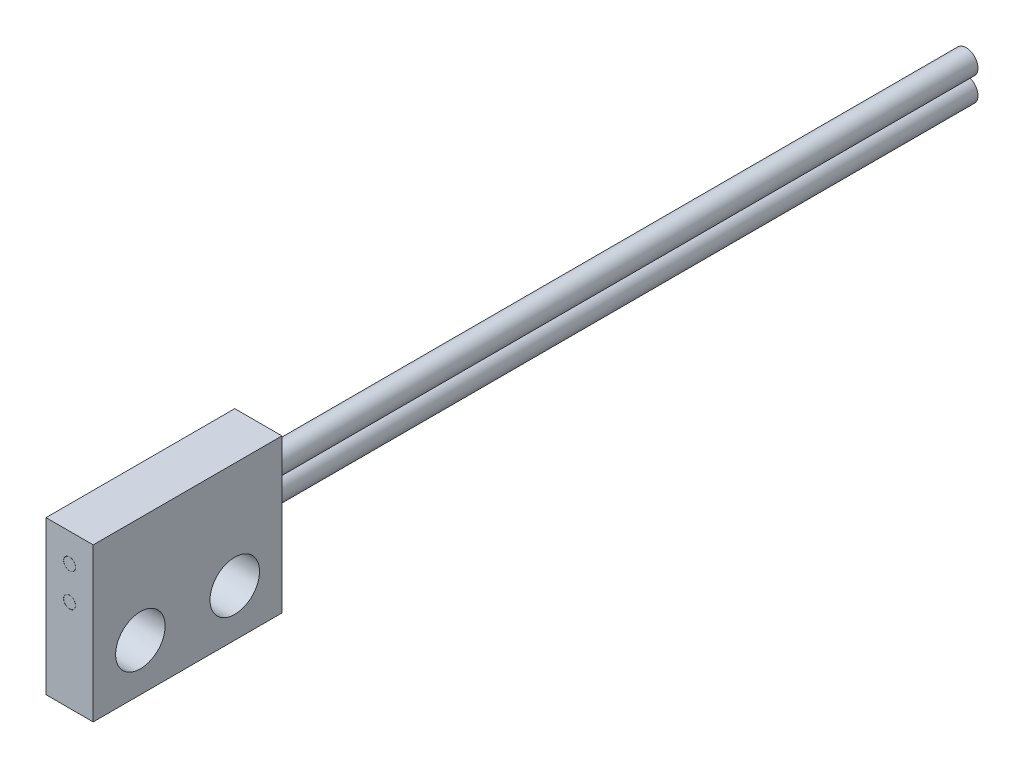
SolidWorks part; units mm, degrees
ref_plane "前视基准面" through (0, 0, 0) normal (0, 0, 1) x (1, 0, 0)
ref_plane "上视基准面" through (0, 0, 0) normal (0, 1, 0) x (1, 0, 0)
ref_plane "右视基准面" through (0, 0, 0) normal (1, 0, 0) x (0, 0, -1)
sketch "草图1" plane through (0, 0, 0) normal (1, 0, 0) x (0, 0, -1)
  line L1 (4, -3.25) -> (-4, -3.25)
  line L2 (4, -3.25) -> (4, 3.25)
  line L3 (4, 3.25) -> (-4, 3.25)
  line L4 (-4, -3.25) -> (-4, 3.25)
  line L5 (4, -3.25) -> (-4, 3.25) construction
  line L6 (4, 3.25) -> (-4, -3.25) construction
  point P0 (0, 0)
  dimension "D1" = 8
  dimension "D2" = 6.5
extrude "凸台-拉伸1" add sketch "草图1" along normal mid plane 2
sketch "草图2" plane through (1, 0, 0) normal (1, 0, 0) x (0, 0, -1)
  line L0 (-4, -3.25) -> (4, -3.25) construction
  line L1 (-4, 3.25) -> (-4, -3.25) construction
  circle A0 centre (-2, -1.25) radius 1.05
  circle A1 centre (2, -1.25) radius 1.05
  point P4 (0, 0)
  dimension "D1" = 2.1
  dimension "D2" = 4
  dimension "D3" = 2
  dimension "D4" = 2
extrude "切除-拉伸1" cut sketch "草图2" against normal blind 2
sketch "草图3" plane through (0, 0, 4) normal (0, 0, 1) x (1, 0, 0)
  line L0 (1, 3.25) -> (-1, 3.25) construction
  circle A0 centre (0, 2.05) radius 0.25
  circle A1 centre (0, 0.65) radius 0.25
  circle A2 centre (0, 2.05) radius 0.255
  circle A3 centre (0, 0.65) radius 0.255
  dimension "D1" = 0.5
  dimension "D4" = 0.51
  dimension "D5" = 0.51
  dimension "D2" = 1.4
  dimension "D3" = 1.2
extrude "切除-拉伸2" cut sketch "草图3" against normal blind 0.1
sketch "草图4" plane through (0, 0, -4) normal (0, 0, -1) x (-1, 0, 0)
  line L0 (-1, 3.25) -> (1, 3.25) construction
  circle A0 centre (0, 1.5) radius 0.5
  circle A1 centre (0, 0.49) radius 0.5
  point P6 (0, 0.2296)
  point P7 (0, 0)
  point P8 (0, 0)
  dimension "D1" = 1
  dimension "D3" = 0.01
  dimension "D2" = 1.75
extrude "凸台-拉伸2" add sketch "草图4" along normal blind 30
